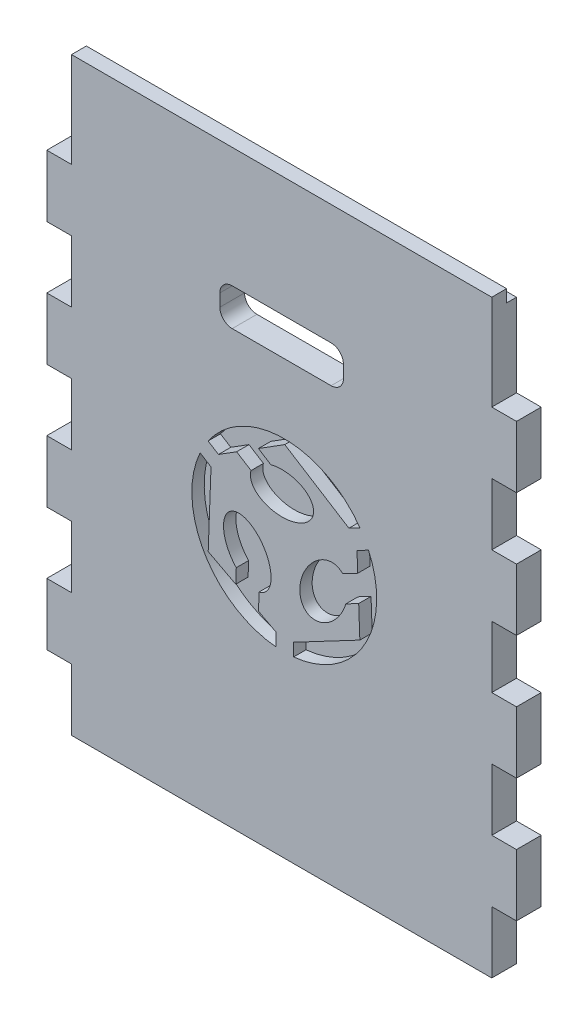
SolidWorks part; units mm, degrees
ref_plane "Front" through (0, 0, 0) normal (0, 0, 1) x (1, 0, 0)
ref_plane "Top" through (0, 0, 0) normal (0, 1, 0) x (1, 0, 0)
ref_plane "Right" through (0, 0, 0) normal (1, 0, 0) x (0, 0, -1)
sketch "Sketch1" plane through (0, 0, 0) normal (0, 0, 1) x (1, 0, 0)
  line L0 (0, 50) -> (20, 50)
  line L1 (20, 0) -> (360, 0)
  line L2 (0, 50) -> (0, 100)
  line L3 (20, 477) -> (360, 477)
  line L4 (380, 50) -> (380, 100)
  line L5 (0, 100) -> (20, 100)
  line L6 (0, 150) -> (20, 150)
  line L7 (0, 200) -> (20, 200)
  line L8 (0, 250) -> (20, 250)
  line L9 (0, 300) -> (20, 300)
  line L10 (0, 350) -> (20, 350)
  line L11 (0, 400) -> (20, 400)
  line L12 (360, 477) -> (360, 400)
  line L13 (20, 0) -> (20, 50)
  line L14 (20, 100) -> (20, 150)
  line L15 (0, 150) -> (0, 200)
  line L16 (20, 200) -> (20, 250)
  line L17 (0, 250) -> (0, 300)
  line L18 (20, 300) -> (20, 350)
  line L19 (0, 350) -> (0, 400)
  line L20 (20, 400) -> (20, 477)
  line L21 (360, 350) -> (380, 350)
  line L22 (360, 400) -> (380, 400)
  line L23 (360, 300) -> (380, 300)
  line L24 (360, 250) -> (380, 250)
  line L25 (360, 200) -> (380, 200)
  line L26 (360, 150) -> (380, 150)
  line L27 (360, 100) -> (380, 100)
  line L28 (360, 50) -> (380, 50)
  line L29 (360, 50) -> (360, 0)
  line L30 (380, 150) -> (380, 200)
  line L31 (360, 150) -> (360, 100)
  line L32 (380, 250) -> (380, 300)
  line L33 (360, 250) -> (360, 200)
  line L34 (380, 350) -> (380, 400)
  line L35 (360, 350) -> (360, 300)
  dimension "D1" = 477
  dimension "D3" = 20
  dimension "D4" = 20
extrude "Extrude1" add sketch "Sketch1" along normal blind 20
sketch "Sketch2" plane through (0, 0, 20) normal (0, 0, 1) x (1, 0, 0)
  line L0 (190, 494.8097) -> (190, 44.8097) construction
  line L1 (150, 380) -> (230, 380)
  line L2 (140, 370) -> (140, 360)
  line L3 (150, 350) -> (230, 350)
  line L4 (240, 370) -> (240, 360)
  line L5 (360, 477) -> (20, 477) construction
  line L6 (380, 350) -> (380, 400) construction
  arc A0 (150, 380) -> (140, 370) centre (150, 370) ccw
  arc A1 (150, 350) -> (140, 360) centre (150, 360) cw
  arc A2 (240, 360) -> (230, 350) centre (230, 360) cw
  arc A3 (230, 380) -> (240, 370) centre (230, 370) cw
  dimension "D2" = 10
  dimension "D1" = 50
  dimension "D3" = 127
  dimension "D4" = 190
  dimension "D5" = 97
  dimension "D6" = 100
extrude "Extrude2" cut sketch "Sketch2" against normal through all
sketch "Sketch3" plane through (0, 0, 20) normal (0, 0, 1) x (1, 0, 0)
  line L30 (252.3295, 208.5571) -> (253.2764, 183.394)
  line L31 (171.2124, 276.5887) -> (192.5309, 289.9902)
  line L32 (130.5149, 261.5164) -> (138.8756, 256.2606)
  line L33 (192.5309, 289.9902) -> (244.4248, 257.3679)
  line L34 (124.0248, 250.0183) -> (132.8605, 244.4638)
  line L35 (199.6691, 155.0761) -> (199.6691, 144.764)
  line L36 (185.4189, 155.1211) -> (185.4189, 144.6851)
  line L37 (181.2256, 270.2941) -> (171.2124, 276.5887)
  line L38 (153.5894, 265.5102) -> (165.2466, 258.1821)
  line L39 (152.8539, 172.3234) -> (130.5886, 184.085)
  line L40 (244.4248, 257.3679) -> (253.3543, 262.0849)
  line L41 (251.5468, 229.3583) -> (239.3719, 222.9269)
  line L42 (171.2596, 162.6007) -> (171.7773, 176.3601)
  line L43 (138.8756, 256.2606) -> (153.5894, 265.5102)
  line L44 (250.9582, 244.9997) -> (260.2814, 249.9247)
  line L45 (130.5886, 184.085) -> (132.8605, 244.4638)
  line L46 (153.2986, 184.1424) -> (152.8539, 172.3234)
  line L47 (250.9582, 244.9997) -> (251.5468, 229.3583)
  line L48 (253.2764, 183.394) -> (199.6691, 155.0761)
  line L49 (185.4189, 155.1211) -> (171.2596, 162.6007)
  line L50 (241.8717, 203.0327) -> (252.3295, 208.5571)
  arc A5 (253.3543, 262.0849) -> (130.5149, 261.5164) centre (192.1319, 219.1564) ccw
  arc A13 (124.0248, 250.0183) -> (185.4189, 144.6851) centre (192.1319, 219.1564) ccw
  arc A14 (199.6691, 144.764) -> (260.2814, 249.9247) centre (192.1319, 219.1564) ccw
  ellipse E0 centre (223.9156, 202.9552) end of major axis (211.132, 180.8133) minor radius 16.5841 (239.3719, 222.9269) -> (241.8717, 203.0327) ccw
  ellipse E1 centre (162.2094, 199.7315) end of major axis (174.993, 177.5897) minor radius 16.5841 (171.7773, 176.3601) -> (153.2986, 184.1424) ccw
  ellipse E2 centre (190.2708, 254.7825) end of major axis (215.8379, 254.7825) minor radius 16.5841 (165.2466, 258.1821) -> (181.2256, 270.2941) ccw
extrude "Extrude3" cut sketch "Sketch3" against normal blind 10
sketch "Sketch4" plane through (0, 0, 0) normal (0, 0, -1) x (-1, 0, 0)
  line L0 (-20, 477) -> (-20, 400) construction
  line L1 (-360, 477) -> (-20, 477)
  line L2 (-360, 477) -> (-360, 467)
  line L3 (-360, 467) -> (-20, 467)
  line L4 (-20, 477) -> (-20, 467)
  dimension "D1" = 10
extrude "Extrude4" cut sketch "Sketch4" against normal blind 8
